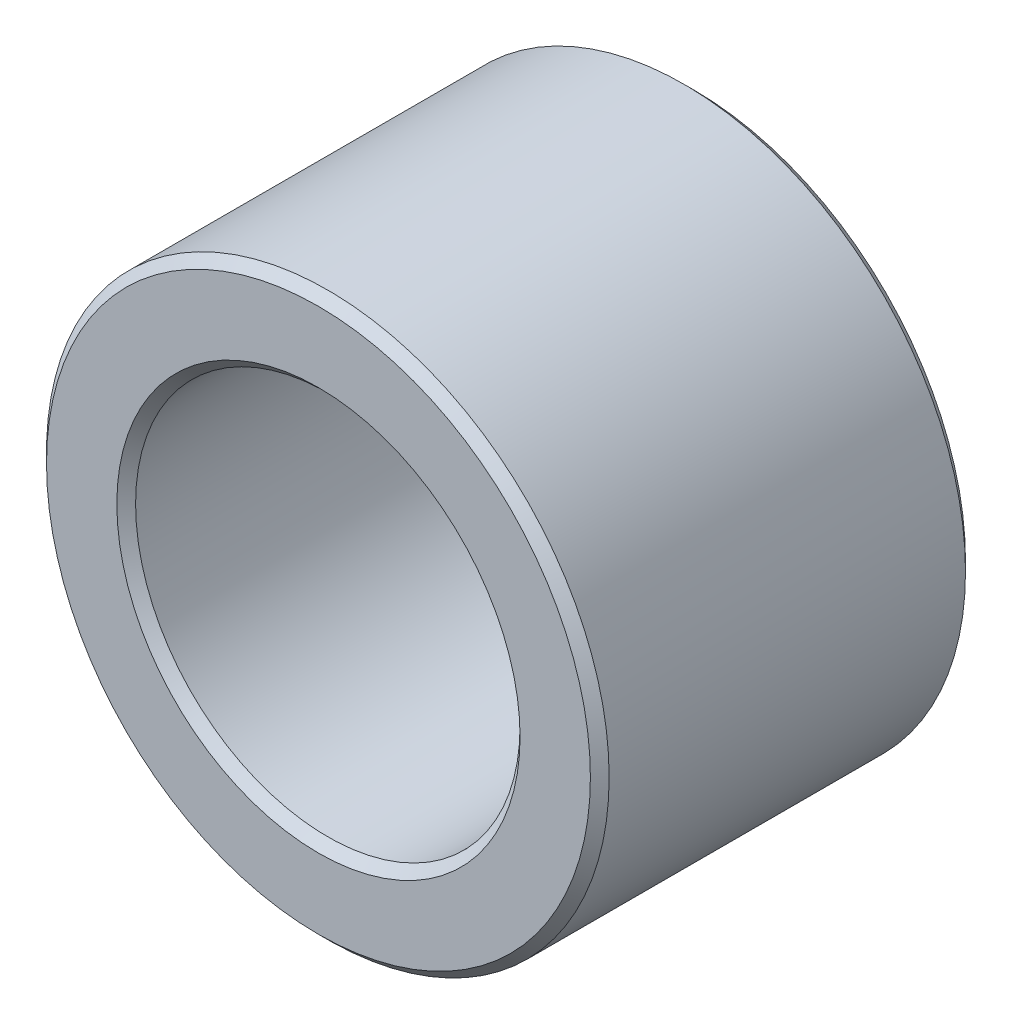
SolidWorks part; units mm, degrees
ref_plane "Front Plane" through (0, 0, 0) normal (0, 0, 1) x (1, 0, 0)
ref_plane "Top Plane" through (0, 0, 0) normal (0, 1, 0) x (1, 0, 0)
ref_plane "Right Plane" through (0, 0, 0) normal (1, 0, 0) x (0, 0, -1)
sketch "Sketch1" plane through (0, 0, 0) normal (0, 0, 1) x (1, 0, 0)
  circle A0 centre (0, 0) radius 6
  circle A1 centre (0, 0) radius 4.1
  dimension "D1" = 12
  dimension "D2" = 8.2
extrude "Boss-Extrude2" add sketch "Sketch1" along normal mid plane 8
chamfer "Chamfer3" distance 0.2 angle 45 4 edges at (6, 0, 4) (6, 0, -4) (4.1, 0, -4) (4.1, 0, 4)
